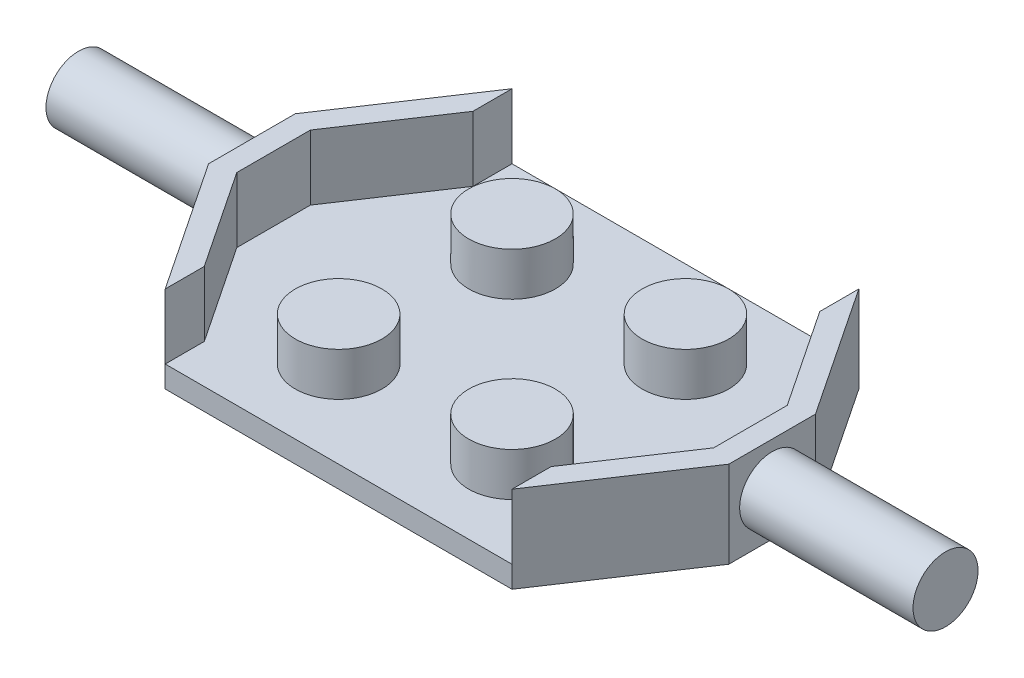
SolidWorks part; units mm, degrees
ref_plane "Front Plane" through (0, 0, 0) normal (0, 0, 1) x (1, 0, 0)
ref_plane "Top Plane" through (0, 0, 0) normal (0, 1, 0) x (1, 0, 0)
ref_plane "Right Plane" through (0, 0, 0) normal (1, 0, 0) x (0, 0, -1)
sketch "Croquis1" plane through (0, 0, 0) normal (0, 1, 0) x (1, 0, 0)
  line L0 (0, 0) -> (0, 8) construction
  line L1 (0, 0) -> (-12, 0) construction
  line L2 (-12, -2) -> (-12, 2)
  line L3 (0, 8) -> (-8, 8)
  line L4 (-8, 8) -> (-12, 2)
  line L5 (0, 8) -> (0, -8)
  line L6 (-8, -8) -> (-12, -2)
  line L7 (0, -8) -> (-8, -8)
  dimension "D1" = 12
  dimension "D2" = 8
  dimension "D3" = 2
  dimension "D4" = 8
extrude "Saliente-Extruir1" add sketch "Croquis1" along normal blind 1
sketch "Croquis2" plane through (0, 1, 0) normal (0, 1, 0) x (1, 0, 0)
  line L0 (0, 8) -> (-8, 8) construction
  line L1 (0, -8) -> (0, 8) construction
  line L2 (0, 0) -> (-2.3636, 0) construction
  circle A0 centre (-4, 4) radius 2
  circle A1 centre (-4, -4) radius 2
  dimension "D1" = 4
  dimension "D2" = 4
  dimension "D3" = 4
extrude "Saliente-Extruir2" add sketch "Croquis2" along normal blind 2
sketch "Croquis3" plane through (0, 1, 0) normal (0, 1, 0) x (1, 0, 0)
  line L0 (-11, 1.6972) -> (-11, -1.6972)
  line L1 (-11, -1.6972) -> (-8, -6.1972)
  line L2 (-11, -1.6972) -> (-7.4648, -7) construction
  line L3 (-7.4648, 7) -> (-11, 1.6972) construction
  line L4 (-8, -6.1972) -> (-8, -8)
  line L5 (-8, 6.1972) -> (-11, 1.6972)
  line L6 (0, -8) -> (0, 8)
  line L7 (0, 8) -> (-8, 8)
  line L8 (-8, 8) -> (-12, 2)
  line L9 (-12, 2) -> (-12, -2)
  line L10 (-12, -2) -> (-8, -8)
  line L11 (-8, -8) -> (0, -8)
  line L14 (-8, 8) -> (-12, 2)
  line L15 (-12, 2) -> (-12, -2)
  line L16 (-12, -2) -> (-8, -8)
  line L18 (-8, 8) -> (-8, 6.1972)
  line L20 (-1, 7) -> (-7.4648, 7) construction
  line L21 (0, 8) -> (-8, 8) construction
  line L22 (0, -8) -> (0, 8) construction
  line L23 (-1, -7) -> (-1, 7) construction
  line L24 (-8, -8) -> (0, -8) construction
  line L25 (-7.4648, -7) -> (-1, -7) construction
  dimension "D1" = 0
  dimension "D2" = 1
extrude "Saliente-Extruir3" add sketch "Croquis3" along normal blind 3
sketch "Croquis4" plane through (-12, 0, 0) normal (-1, 0, 0) x (0, 0, 1)
  line L0 (0, 4) -> (0, 0) construction
  line L1 (-2, 4) -> (2, 4) construction
  line L2 (-2, 0) -> (2, 0) construction
  circle A0 centre (0, 2) radius 1.5
  dimension "D1" = 3
extrude "Saliente-Extruir4" add sketch "Croquis4" along normal blind 8
mirror "Simetría1" about plane through (0, 1, -8) normal (-1, 0, 0) of "Saliente-Extruir2", "Saliente-Extruir1", "Saliente-Extruir3", "Saliente-Extruir4"
